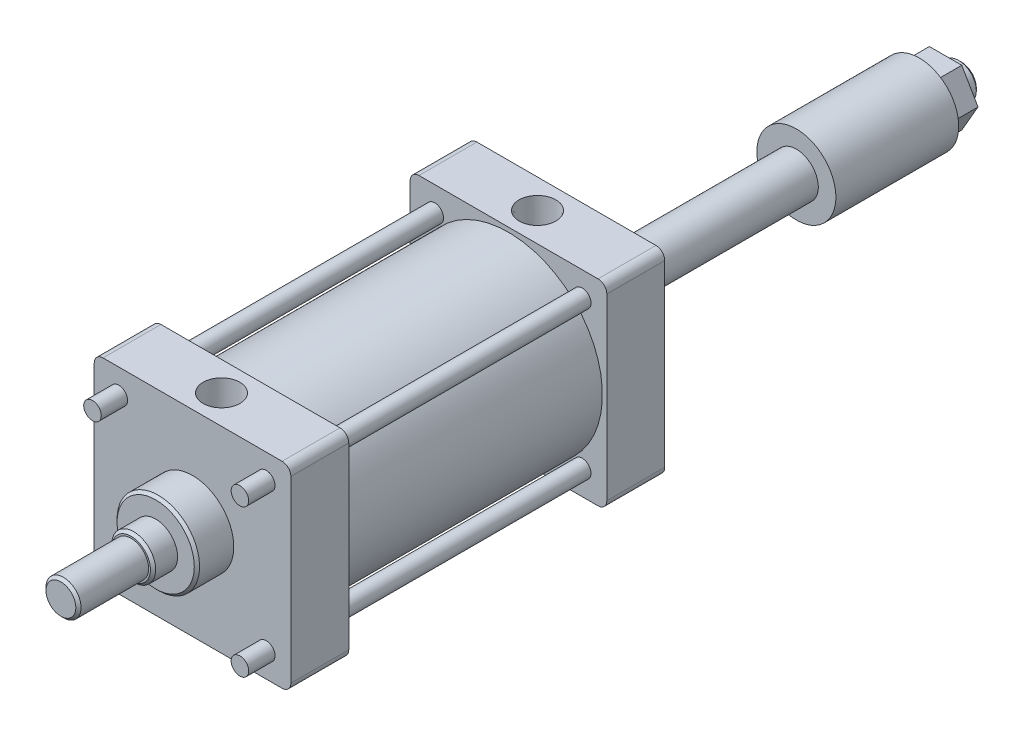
SolidWorks part; units mm, degrees
ref_plane "前视基准面" through (0, 0, 0) normal (0, 0, 1) x (1, 0, 0)
ref_plane "上视基准面" through (0, 0, 0) normal (0, 1, 0) x (1, 0, 0)
ref_plane "右视基准面" through (0, 0, 0) normal (1, 0, 0) x (0, 0, -1)
sketch "草图1" plane through (0, 0, 0) normal (0, 0, 1) x (1, 0, 0)
  line L0 (0, 0) -> (42, 0) construction
  line L1 (51, 56) -> (-51, 56)
  line L2 (56, 51) -> (56, -51)
  line L3 (51, -56) -> (-51, -56)
  line L4 (-56, 51) -> (-56, -51)
  line L5 (56, 56) -> (-56, -56) construction
  line L6 (56, -56) -> (-56, 56) construction
  line L7 (42, 0) -> (42, -42) construction
  arc A0 (51, 56) -> (56, 51) centre (51, 51) cw
  arc A1 (56, -51) -> (51, -56) centre (51, -51) cw
  arc A2 (-56, -51) -> (-51, -56) centre (-51, -51) ccw
  arc A3 (-56, 51) -> (-51, 56) centre (-51, 51) cw
  circle A4 centre (42, -42) radius 5
  circle A5 centre (-42, -42) radius 5
  circle A6 centre (-42, 42) radius 5
  circle A7 centre (42, 42) radius 5
  point P0 (0, 0)
  point P31 (0, 0)
  dimension "D3" = 5
  dimension "D4" = 4
  dimension "D1" = 112
  dimension "D2" = 112
extrude "凸台-拉伸1" add sketch "草图1" along normal blind 33
sketch "草图2" plane through (0, 0, 33) normal (0, 0, 1) x (1, 0, 0)
  circle A0 centre (0, 0) radius 23.5
extrude "凸台-拉伸2" add sketch "草图2" along normal blind 21
sketch "草图3" plane through (0, 0, 54) normal (0, 0, 1) x (1, 0, 0)
  circle A0 centre (0, 0) radius 12.5
extrude "凸台-拉伸3" add sketch "草图3" along normal blind 14
sketch "草图4" plane through (0, 0, 68) normal (0, 0, 1) x (1, 0, 0)
  circle A0 centre (0, 0) radius 10
extrude "凸台-拉伸4" add sketch "草图4" along normal blind 40
chamfer "倒角1" distance 1.5 angle 45 3 edges at (10, 0, 108) (12.5, 0, 68) (23.5, 0, 54)
sketch "草图5" plane through (0, 0, 0) normal (0, 0, -1) x (-1, 0, 0)
  circle A0 centre (0, 0) radius 53.5
extrude "凸台-拉伸5" add sketch "草图5" along normal blind 147
sketch "草图7" plane through (0, 0, -147) normal (0, 0, -1) x (-1, 0, 0)
  line L4 (-56, 51) -> (-56, -51)
  line L5 (-51, -56) -> (51, -56)
  line L6 (56, -51) -> (56, 51)
  line L7 (51, 56) -> (-51, 56)
  line L8 (-56, 51) -> (-56, -51)
  line L9 (-51, -56) -> (51, -56)
  line L10 (56, -51) -> (56, 51)
  line L11 (51, 56) -> (-51, 56)
  circle A0 centre (42, -42) radius 5 construction
  circle A1 centre (-42, -42) radius 5 construction
  circle A2 centre (42, 42) radius 5 construction
  circle A3 centre (-42, 42) radius 5 construction
  arc A4 (-51, 56) -> (-56, 51) centre (-51, 51) ccw
  arc A5 (-56, -51) -> (-51, -56) centre (-51, -51) ccw
  arc A6 (51, -56) -> (56, -51) centre (51, -51) ccw
  arc A7 (56, 51) -> (51, 56) centre (51, 51) ccw
  arc A8 (-51, 56) -> (-56, 51) centre (-51, 51) ccw
  arc A9 (-56, -51) -> (-51, -56) centre (-51, -51) ccw
  arc A10 (51, -56) -> (56, -51) centre (51, -51) ccw
  arc A11 (56, 51) -> (51, 56) centre (51, 51) ccw
  circle A12 centre (42, -42) radius 5
  circle A13 centre (-42, -42) radius 5
  circle A14 centre (42, 42) radius 5
  circle A15 centre (-42, 42) radius 5
  dimension "D1" = 0
extrude "凸台-拉伸6" add sketch "草图7" along normal blind 33
sketch "草图8" plane through (0, 0, -180) normal (0, 0, -1) x (-1, 0, 0)
  circle A0 centre (0, 0) radius 23.5
extrude "凸台-拉伸7" add sketch "草图8" along normal blind 21
chamfer "倒角2" distance 1.5 angle 45 1 edges at (-23.5, 0, -201)
sketch "草图9" plane through (0, 0, -201) normal (0, 0, -1) x (-1, 0, 0)
  circle A0 centre (0, 0) radius 22.5
extrude "凸台-拉伸8" add sketch "草图9" along normal blind 10
sketch "草图10" plane through (0, 0, -211) normal (0, 0, -1) x (-1, 0, 0)
  circle A0 centre (0, 0) radius 12.5
extrude "凸台-拉伸9" add sketch "草图10" along normal blind 100
sketch "草图11" plane through (0, 0, -311) normal (0, 0, -1) x (-1, 0, 0)
  circle A0 centre (0, 0) radius 22.5
extrude "凸台-拉伸10" add sketch "草图11" along normal blind 70
sketch "草图12" plane through (0, 0, -381) normal (0, 0, -1) x (-1, 0, 0)
  line L1 (18.4752, 0) -> (9.2376, 16)
  line L2 (9.2376, 16) -> (-9.2376, 16)
  line L3 (-9.2376, 16) -> (-18.4752, 0)
  line L4 (-18.4752, 0) -> (-9.2376, -16)
  line L5 (-9.2376, -16) -> (9.2376, -16)
  line L6 (9.2376, -16) -> (18.4752, 0)
  circle A0 centre (0, 0) radius 16 construction
extrude "凸台-拉伸11" add sketch "草图12" along normal blind 15
sketch "草图13" plane through (0, 0, -396) normal (0, 0, -1) x (-1, 0, 0)
  circle A0 centre (0, 0) radius 10
extrude "凸台-拉伸12" add sketch "草图13" along normal blind 9
chamfer "倒角3" distance 1.5 angle 45 1 edges at (-10, 0, -405)
sketch "草图14" plane through (0, 0, 33) normal (0, 0, 1) x (1, 0, 0)
  circle A0 centre (-42, 42) radius 5 construction
  circle A1 centre (42, 42) radius 5 construction
  circle A2 centre (42, -42) radius 5 construction
  circle A3 centre (-42, -42) radius 5 construction
  circle A4 centre (-42, 42) radius 5
  circle A5 centre (42, 42) radius 5
  circle A6 centre (42, -42) radius 5
  circle A7 centre (-42, -42) radius 5
extrude "凸台-拉伸13" add sketch "草图14" along normal blind 15 and the other way up to surface (213 mm away) separate body
hole_wizard "1/2 Rc 螺纹孔1" positions "草图15" profile "草图16" size "1/2" standard "ISO"
sketch "草图15" plane through (0, 56, 0) normal (0, 1, 0) x (1, 0, 0)
  line L0 (51, 0) -> (-51, 0) construction
  line L1 (-51, 147) -> (51, 147) construction
  point P0 (0, -16.5)
  point P2 (0, 163.5)
  dimension "D1" = 16.5
  dimension "D2" = 16.5
sketch "草图16" plane through (0, 56, 16.5) normal (1, 0, 0) x (0, 0, 1)
  line L0 (0, 0) -> (0, 29.3275)
  line L1 (8.75, 24.07) -> (0, 29.3275)
  line L2 (-8.75, 24.07) -> (0, 29.3275) construction
  line L3 (8.75, 24.07) -> (8.75, 15)
  line L4 (8.75, 15) -> (10.0093, 15)
  line L5 (10.0093, 15) -> (10.4775, 0)
  line L6 (-10.0093, 15) -> (-10.4775, 0) construction
  line L7 (10.4775, 0) -> (0, 0)
  line L8 (0, -6.35) -> (0, 107.95) construction
  line L11 (-8.75, 15) -> (-10.0093, 15) construction
  dimension "螺纹孔钻头直径" = 17.5
  dimension "螺纹孔钻头深度" = 24.07
  dimension "螺纹直径" = 20.955
  dimension "螺纹角度" = 3.576
  dimension "螺纹深度" = 15
  dimension "导头角度" = 118
